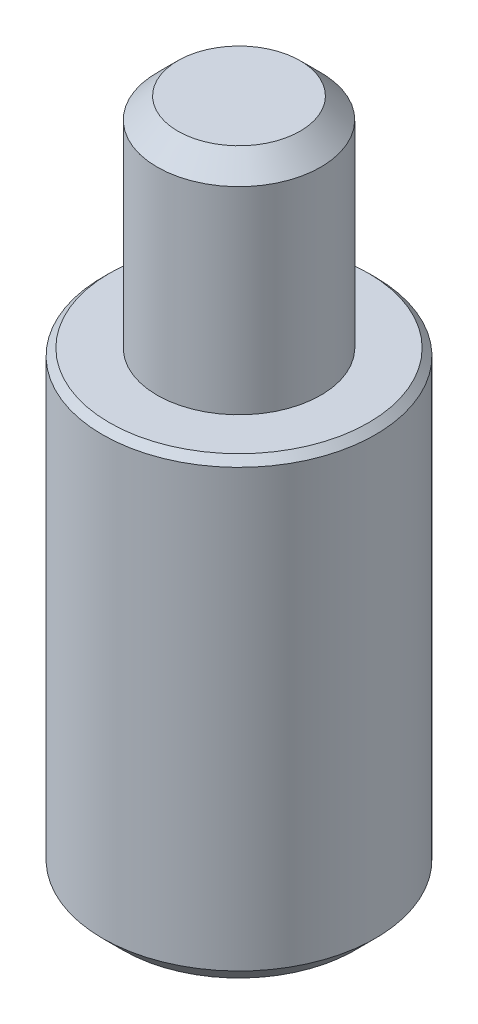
SolidWorks part; units mm, degrees
ref_plane "Front Plane" through (0, 0, 0) normal (0, 0, 1) x (1, 0, 0)
ref_plane "Top Plane" through (0, 0, 0) normal (0, 1, 0) x (1, 0, 0)
ref_plane "Right Plane" through (0, 0, 0) normal (1, 0, 0) x (0, 0, -1)
sketch "Sketch1" plane through (0, 0, 0) normal (0, 1, 0) x (1, 0, 0)
  circle A0 centre (0, 0) radius 5
  dimension "D1" = 10
extrude "Extrude1" add sketch "Sketch1" along normal blind 17
sketch "Sketch2" plane through (0, 17, 0) normal (0, 1, 0) x (1, 0, 0)
  circle A0 centre (0, 0) radius 3
  dimension "D1" = 6
extrude "Extrude2" add sketch "Sketch2" along normal blind 8
chamfer "Chamfer1" distance 0.254 angle 45 1 edges at (0, 17, 5)
sketch "Sketch3" plane through (0, 0, 0) normal (0, -1, 0) x (1, 0, 0)
  line L1 (1.4434, 2.5) -> (-1.4434, 2.5)
  line L2 (-1.4434, 2.5) -> (-2.8868, 0)
  line L3 (-2.8868, 0) -> (-1.4434, -2.5)
  line L4 (-1.4434, -2.5) -> (1.4434, -2.5)
  line L5 (1.4434, -2.5) -> (2.8868, 0)
  line L6 (2.8868, 0) -> (1.4434, 2.5)
  circle A0 centre (0, 0) radius 2.5 construction
  dimension "D1" = 5
extrude "Extrude3" cut sketch "Sketch3" against normal blind 5
chamfer "Chamfer2" distance 0.762 angle 45 1 edges at (0, 0, 5)
chamfer "Chamfer3" distance 0.76 angle 45 1 edges at (0, 25, 3)
